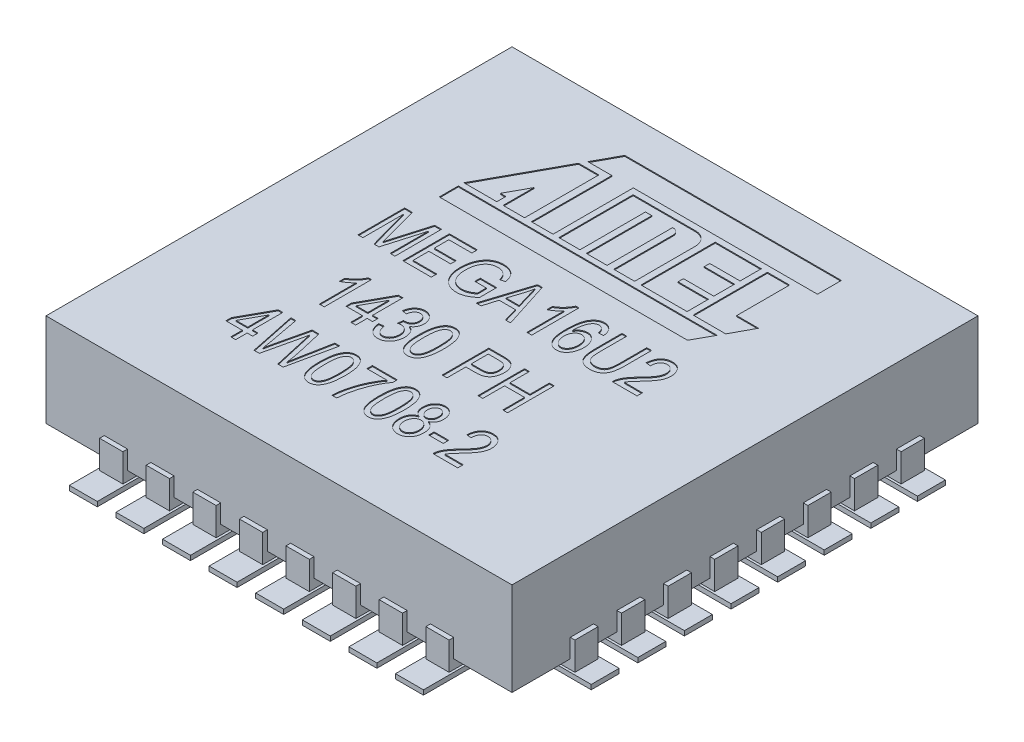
SolidWorks part; units mm, degrees
ref_plane "Plan de face" through (0, 0, 0) normal (0, 0, 1) x (1, 0, 0)
ref_plane "Plan de dessus" through (0, 0, 0) normal (0, 1, 0) x (1, 0, 0)
ref_plane "Plan de droite" through (0, 0, 0) normal (1, 0, 0) x (0, 0, -1)
sketch "Esquisse1" plane through (0, 0, 0) normal (0, 1, 0) x (1, 0, 0)
  line L1 (0, 0) -> (5, 0)
  line L2 (0, 0) -> (0, 5)
  line L3 (0, 5) -> (5, 5)
  line L4 (5, 0) -> (5, 5)
  dimension "D1" = 5
  dimension "D2" = 5
extrude "Boss.-Extru.1" add sketch "Esquisse1" along normal blind 1
sketch "Esquisse2" plane through (0, 0, 0) normal (0, -1, 0) x (1, 0, 0)
  line L0 (0, 0) -> (5, 0) construction
  line L1 (0.625, 0.05) -> (0.875, 0.05)
  line L2 (0.625, 0.05) -> (0.625, -0.2)
  line L3 (1.125, 0.05) -> (1.375, 0.05)
  line L4 (0.875, 0.05) -> (0.875, -0.2)
  line L5 (1.125, 0.05) -> (1.125, -0.2)
  line L6 (1.375, 0.05) -> (1.375, -0.2)
  line L7 (1.625, 0.05) -> (1.875, 0.05)
  line L8 (1.625, 0.05) -> (1.625, -0.2)
  line L9 (1.875, 0.05) -> (1.875, -0.2)
  line L10 (2.125, 0.05) -> (2.375, 0.05)
  line L11 (2.125, 0.05) -> (2.125, -0.2)
  line L12 (2.375, 0.05) -> (2.375, -0.2)
  line L13 (2.625, 0.05) -> (2.875, 0.05)
  line L14 (2.625, 0.05) -> (2.625, -0.2)
  line L15 (2.875, 0.05) -> (2.875, -0.2)
  line L16 (3.125, 0.05) -> (3.375, 0.05)
  line L17 (3.125, 0.05) -> (3.125, -0.2)
  line L18 (3.375, 0.05) -> (3.375, -0.2)
  line L19 (3.625, 0.05) -> (3.875, 0.05)
  line L20 (3.625, 0.05) -> (3.625, -0.2)
  line L21 (3.875, 0.05) -> (3.875, -0.2)
  line L22 (4.125, 0.05) -> (4.375, 0.05)
  line L23 (4.125, 0.05) -> (4.125, -0.2)
  line L24 (4.375, 0.05) -> (4.375, -0.2)
  line L25 (0.625, 0.05) -> (0, 0) construction
  line L26 (4.375, 0.05) -> (5, 0) construction
  line L27 (-0.05, -1.125) -> (-0.05, -1.375)
  line L28 (0.2, -0.625) -> (-0.05, -0.625)
  line L29 (-0.05, -0.625) -> (-0.05, -0.875)
  line L30 (-0.05, -0.875) -> (0.2, -0.875)
  line L31 (0, -5) -> (0, 0) construction
  line L32 (0.2, -1.125) -> (-0.05, -1.125)
  line L33 (-0.05, -1.375) -> (0.2, -1.375)
  line L34 (-0.05, -1.625) -> (-0.05, -1.875)
  line L35 (0.2, -1.625) -> (-0.05, -1.625)
  line L36 (-0.05, -1.875) -> (0.2, -1.875)
  line L37 (-0.05, -2.125) -> (-0.05, -2.375)
  line L38 (0.2, -2.125) -> (-0.05, -2.125)
  line L39 (-0.05, -2.375) -> (0.2, -2.375)
  line L40 (-0.05, -2.625) -> (-0.05, -2.875)
  line L41 (0.2, -2.625) -> (-0.05, -2.625)
  line L42 (-0.05, -2.875) -> (0.2, -2.875)
  line L43 (-0.05, -3.125) -> (-0.05, -3.375)
  line L44 (0.2, -3.125) -> (-0.05, -3.125)
  line L45 (-0.05, -3.375) -> (0.2, -3.375)
  line L46 (-0.05, -3.625) -> (-0.05, -3.875)
  line L47 (0.2, -3.625) -> (-0.05, -3.625)
  line L48 (-0.05, -3.875) -> (0.2, -3.875)
  line L49 (-0.05, -4.125) -> (-0.05, -4.375)
  line L50 (0.2, -4.125) -> (-0.05, -4.125)
  line L51 (-0.05, -4.375) -> (0.2, -4.375)
  line L52 (-0.05, -0.625) -> (0, 0) construction
  line L53 (-0.05, -4.375) -> (0, -5) construction
  line L54 (0.625, -5.05) -> (0.625, -4.8)
  line L55 (0.625, -5.05) -> (0.875, -5.05)
  line L56 (0.875, -5.05) -> (0.875, -4.8)
  line L57 (5, -5) -> (0, -5) construction
  line L58 (1.125, -5.05) -> (1.375, -5.05)
  line L59 (1.125, -5.05) -> (1.125, -4.8)
  line L60 (1.375, -5.05) -> (1.375, -4.8)
  line L61 (1.625, -5.05) -> (1.875, -5.05)
  line L62 (1.625, -5.05) -> (1.625, -4.8)
  line L63 (1.875, -5.05) -> (1.875, -4.8)
  line L64 (2.125, -5.05) -> (2.375, -5.05)
  line L65 (2.125, -5.05) -> (2.125, -4.8)
  line L66 (2.375, -5.05) -> (2.375, -4.8)
  line L67 (2.625, -5.05) -> (2.875, -5.05)
  line L68 (2.625, -5.05) -> (2.625, -4.8)
  line L69 (2.875, -5.05) -> (2.875, -4.8)
  line L70 (3.125, -5.05) -> (3.375, -5.05)
  line L71 (3.125, -5.05) -> (3.125, -4.8)
  line L72 (3.375, -5.05) -> (3.375, -4.8)
  line L73 (3.625, -5.05) -> (3.875, -5.05)
  line L74 (3.625, -5.05) -> (3.625, -4.8)
  line L75 (3.875, -5.05) -> (3.875, -4.8)
  line L76 (4.125, -5.05) -> (4.375, -5.05)
  line L77 (4.125, -5.05) -> (4.125, -4.8)
  line L78 (4.375, -5.05) -> (4.375, -4.8)
  line L79 (0, -5) -> (0.625, -5.05) construction
  line L80 (4.375, -5.05) -> (5, -5) construction
  line L81 (4.8, -4.375) -> (5.05, -4.375)
  line L82 (5.05, -4.375) -> (5.05, -4.125)
  line L83 (5.05, -4.125) -> (4.8, -4.125)
  line L84 (5, 0) -> (5, -5) construction
  line L85 (4.8, -3.875) -> (5.05, -3.875)
  line L86 (5.05, -3.875) -> (5.05, -3.625)
  line L87 (5.05, -3.625) -> (4.8, -3.625)
  line L88 (4.8, -3.375) -> (5.05, -3.375)
  line L89 (5.05, -3.375) -> (5.05, -3.125)
  line L90 (5.05, -3.125) -> (4.8, -3.125)
  line L91 (4.8, -2.875) -> (5.05, -2.875)
  line L92 (5.05, -2.875) -> (5.05, -2.625)
  line L93 (5.05, -2.625) -> (4.8, -2.625)
  line L94 (4.8, -2.375) -> (5.05, -2.375)
  line L95 (5.05, -2.375) -> (5.05, -2.125)
  line L96 (5.05, -2.125) -> (4.8, -2.125)
  line L97 (4.8, -1.875) -> (5.05, -1.875)
  line L98 (5.05, -1.875) -> (5.05, -1.625)
  line L99 (5.05, -1.625) -> (4.8, -1.625)
  line L100 (4.8, -1.375) -> (5.05, -1.375)
  line L101 (5.05, -1.375) -> (5.05, -1.125)
  line L102 (5.05, -1.125) -> (4.8, -1.125)
  line L103 (4.8, -0.875) -> (5.05, -0.875)
  line L104 (5.05, -0.875) -> (5.05, -0.625)
  line L105 (5.05, -0.625) -> (4.8, -0.625)
  line L106 (5, -5) -> (5.05, -4.375) construction
  line L107 (5, 0) -> (5.05, -0.625) construction
  arc A0 (0.625, -0.2) -> (0.875, -0.2) centre (0.75, -0.2) ccw
  arc A1 (1.125, -0.2) -> (1.375, -0.2) centre (1.25, -0.2) ccw
  arc A2 (1.625, -0.2) -> (1.875, -0.2) centre (1.75, -0.2) ccw
  arc A3 (2.125, -0.2) -> (2.375, -0.2) centre (2.25, -0.2) ccw
  arc A4 (2.625, -0.2) -> (2.875, -0.2) centre (2.75, -0.2) ccw
  arc A5 (3.125, -0.2) -> (3.375, -0.2) centre (3.25, -0.2) ccw
  arc A6 (3.625, -0.2) -> (3.875, -0.2) centre (3.75, -0.2) ccw
  arc A7 (4.125, -0.2) -> (4.375, -0.2) centre (4.25, -0.2) ccw
  arc A8 (0.2, -0.875) -> (0.2, -0.625) centre (0.2, -0.75) ccw
  arc A9 (0.2, -1.375) -> (0.2, -1.125) centre (0.2, -1.25) ccw
  arc A10 (0.2, -1.875) -> (0.2, -1.625) centre (0.2, -1.75) ccw
  arc A11 (0.2, -2.375) -> (0.2, -2.125) centre (0.2, -2.25) ccw
  arc A12 (0.2, -2.875) -> (0.2, -2.625) centre (0.2, -2.75) ccw
  arc A13 (0.2, -3.375) -> (0.2, -3.125) centre (0.2, -3.25) ccw
  arc A14 (0.2, -3.875) -> (0.2, -3.625) centre (0.2, -3.75) ccw
  arc A15 (0.2, -4.375) -> (0.2, -4.125) centre (0.2, -4.25) ccw
  arc A16 (0.875, -4.8) -> (0.625, -4.8) centre (0.75, -4.8) ccw
  arc A17 (1.375, -4.8) -> (1.125, -4.8) centre (1.25, -4.8) ccw
  arc A18 (1.875, -4.8) -> (1.625, -4.8) centre (1.75, -4.8) ccw
  arc A19 (2.375, -4.8) -> (2.125, -4.8) centre (2.25, -4.8) ccw
  arc A20 (2.875, -4.8) -> (2.625, -4.8) centre (2.75, -4.8) ccw
  arc A21 (3.375, -4.8) -> (3.125, -4.8) centre (3.25, -4.8) ccw
  arc A22 (3.875, -4.8) -> (3.625, -4.8) centre (3.75, -4.8) ccw
  arc A23 (4.375, -4.8) -> (4.125, -4.8) centre (4.25, -4.8) ccw
  arc A24 (4.8, -4.375) -> (4.8, -4.125) centre (4.8, -4.25) cw
  arc A25 (4.8, -3.875) -> (4.8, -3.625) centre (4.8, -3.75) cw
  arc A26 (4.8, -3.375) -> (4.8, -3.125) centre (4.8, -3.25) cw
  arc A27 (4.8, -2.875) -> (4.8, -2.625) centre (4.8, -2.75) cw
  arc A28 (4.8, -2.375) -> (4.8, -2.125) centre (4.8, -2.25) cw
  arc A29 (4.8, -1.875) -> (4.8, -1.625) centre (4.8, -1.75) cw
  arc A30 (4.8, -1.375) -> (4.8, -1.125) centre (4.8, -1.25) cw
  arc A31 (4.8, -0.875) -> (4.8, -0.625) centre (4.8, -0.75) cw
  dimension "D1" = 0.25
  dimension "D2" = 0.05
  dimension "D3" = 0.25
  dimension "D5" = 0.25
  dimension "D6" = 0.05
  dimension "D7" = 0.25
  dimension "D9" = 0.25
  dimension "D10" = 0.05
  dimension "D11" = 0.25
  dimension "D13" = 0.25
  dimension "D14" = 0.05
  dimension "D15" = 0.25
  dimension "D4" = 8
  dimension "D8" = 8
  dimension "D12" = 8
  dimension "D16" = 8
extrude "Boss.-Extru.2" add sketch "Esquisse2" along normal blind 0.1 separate body
sketch "Esquisse3" plane through (0, 0, 0) normal (0, 1, 0) x (1, 0, 0)
  line L0 (0.875, 5.05) -> (0.875, 4.8) construction
  line L1 (0.625, 5.05) -> (0.875, 5.05)
  line L2 (0.625, 5.05) -> (0.625, 5)
  line L3 (0.625, 5) -> (0.875, 5)
  line L4 (0.875, 5.05) -> (0.875, 5)
  line L5 (5, 5) -> (0, 5) construction
  line L6 (1.125, 5.05) -> (1.125, 5)
  line L7 (1.125, 5.05) -> (1.375, 5.05)
  line L8 (1.375, 5.05) -> (1.375, 5)
  line L9 (1.125, 5) -> (1.375, 5)
  line L10 (1.625, 5.05) -> (1.625, 5)
  line L11 (1.625, 5.05) -> (1.875, 5.05)
  line L12 (1.875, 5.05) -> (1.875, 5)
  line L13 (1.625, 5) -> (1.875, 5)
  line L14 (2.125, 5.05) -> (2.125, 5)
  line L15 (2.125, 5.05) -> (2.375, 5.05)
  line L16 (2.375, 5.05) -> (2.375, 5)
  line L17 (2.125, 5) -> (2.375, 5)
  line L18 (2.625, 5.05) -> (2.625, 5)
  line L19 (2.625, 5.05) -> (2.875, 5.05)
  line L20 (2.875, 5.05) -> (2.875, 5)
  line L21 (2.625, 5) -> (2.875, 5)
  line L22 (3.125, 5.05) -> (3.125, 5)
  line L23 (3.125, 5.05) -> (3.375, 5.05)
  line L24 (3.375, 5.05) -> (3.375, 5)
  line L25 (3.125, 5) -> (3.375, 5)
  line L26 (3.625, 5.05) -> (3.625, 5)
  line L27 (3.625, 5.05) -> (3.875, 5.05)
  line L28 (3.875, 5.05) -> (3.875, 5)
  line L29 (3.625, 5) -> (3.875, 5)
  line L30 (4.125, 5.05) -> (4.125, 5)
  line L31 (4.125, 5.05) -> (4.375, 5.05)
  line L32 (4.375, 5.05) -> (4.375, 5)
  line L33 (4.125, 5) -> (4.375, 5)
  line L34 (5, 0) -> (5, 5) construction
  line L35 (5.05, 4.375) -> (5, 4.375)
  line L36 (5.05, 4.375) -> (5.05, 4.125)
  line L37 (5.05, 4.125) -> (5, 4.125)
  line L38 (5, 4.375) -> (5, 4.125)
  line L39 (5.05, 4.125) -> (4.8, 4.125) construction
  line L40 (5.05, 3.875) -> (5, 3.875)
  line L41 (5.05, 3.875) -> (5.05, 3.625)
  line L42 (5.05, 3.625) -> (5, 3.625)
  line L43 (5, 3.875) -> (5, 3.625)
  line L44 (5.05, 3.375) -> (5, 3.375)
  line L45 (5.05, 3.375) -> (5.05, 3.125)
  line L46 (5.05, 3.125) -> (5, 3.125)
  line L47 (5, 3.375) -> (5, 3.125)
  line L48 (5.05, 2.875) -> (5, 2.875)
  line L49 (5.05, 2.875) -> (5.05, 2.625)
  line L50 (5.05, 2.625) -> (5, 2.625)
  line L51 (5, 2.875) -> (5, 2.625)
  line L52 (5.05, 2.375) -> (5, 2.375)
  line L53 (5.05, 2.375) -> (5.05, 2.125)
  line L54 (5.05, 2.125) -> (5, 2.125)
  line L55 (5, 2.375) -> (5, 2.125)
  line L56 (5.05, 1.875) -> (5, 1.875)
  line L57 (5.05, 1.875) -> (5.05, 1.625)
  line L58 (5.05, 1.625) -> (5, 1.625)
  line L59 (5, 1.875) -> (5, 1.625)
  line L60 (5.05, 1.375) -> (5, 1.375)
  line L61 (5.05, 1.375) -> (5.05, 1.125)
  line L62 (5.05, 1.125) -> (5, 1.125)
  line L63 (5, 1.375) -> (5, 1.125)
  line L64 (5.05, 0.875) -> (5, 0.875)
  line L65 (5.05, 0.875) -> (5.05, 0.625)
  line L66 (5.05, 0.625) -> (5, 0.625)
  line L67 (5, 0.875) -> (5, 0.625)
  line L68 (0, 0) -> (5, 0) construction
  line L69 (4.375, -0.05) -> (4.125, -0.05)
  line L70 (4.375, -0.05) -> (4.375, 0)
  line L71 (4.375, 0) -> (4.125, 0)
  line L72 (4.125, -0.05) -> (4.125, 0)
  line L73 (3.875, 0) -> (3.625, 0)
  line L74 (3.625, -0.05) -> (3.625, 0)
  line L75 (3.875, -0.05) -> (3.625, -0.05)
  line L76 (3.875, -0.05) -> (3.875, 0)
  line L77 (3.375, 0) -> (3.125, 0)
  line L78 (3.125, -0.05) -> (3.125, 0)
  line L79 (3.375, -0.05) -> (3.125, -0.05)
  line L80 (3.375, -0.05) -> (3.375, 0)
  line L81 (2.875, 0) -> (2.625, 0)
  line L82 (2.625, -0.05) -> (2.625, 0)
  line L83 (2.875, -0.05) -> (2.625, -0.05)
  line L84 (2.875, -0.05) -> (2.875, 0)
  line L85 (2.375, 0) -> (2.125, 0)
  line L86 (2.125, -0.05) -> (2.125, 0)
  line L87 (2.375, -0.05) -> (2.125, -0.05)
  line L88 (2.375, -0.05) -> (2.375, 0)
  line L89 (1.875, 0) -> (1.625, 0)
  line L90 (1.625, -0.05) -> (1.625, 0)
  line L91 (1.875, -0.05) -> (1.625, -0.05)
  line L92 (1.875, -0.05) -> (1.875, 0)
  line L93 (1.375, 0) -> (1.125, 0)
  line L94 (1.125, -0.05) -> (1.125, 0)
  line L95 (1.375, -0.05) -> (1.125, -0.05)
  line L96 (1.375, -0.05) -> (1.375, 0)
  line L97 (0.875, 0) -> (0.625, 0)
  line L98 (0.625, -0.05) -> (0.625, 0)
  line L99 (0.875, -0.05) -> (0.625, -0.05)
  line L100 (0.875, -0.05) -> (0.875, 0)
  line L101 (0.2, 0.625) -> (-0.05, 0.625) construction
  line L102 (-0.05, 0.875) -> (0, 0.875)
  line L103 (-0.05, 0.875) -> (-0.05, 0.625)
  line L104 (-0.05, 0.625) -> (0, 0.625)
  line L105 (0, 0.875) -> (0, 0.625)
  line L106 (0, 5) -> (0, 0) construction
  line L107 (-0.05, 1.375) -> (0, 1.375)
  line L108 (-0.05, 1.375) -> (-0.05, 1.125)
  line L109 (-0.05, 1.125) -> (0, 1.125)
  line L110 (0, 1.375) -> (0, 1.125)
  line L111 (-0.05, 1.875) -> (0, 1.875)
  line L112 (-0.05, 1.875) -> (-0.05, 1.625)
  line L113 (-0.05, 1.625) -> (0, 1.625)
  line L114 (0, 1.875) -> (0, 1.625)
  line L115 (-0.05, 2.375) -> (0, 2.375)
  line L116 (-0.05, 2.375) -> (-0.05, 2.125)
  line L117 (-0.05, 2.125) -> (0, 2.125)
  line L118 (0, 2.375) -> (0, 2.125)
  line L119 (-0.05, 2.875) -> (0, 2.875)
  line L120 (-0.05, 2.875) -> (-0.05, 2.625)
  line L121 (-0.05, 2.625) -> (0, 2.625)
  line L122 (0, 2.875) -> (0, 2.625)
  line L123 (-0.05, 3.375) -> (0, 3.375)
  line L124 (-0.05, 3.375) -> (-0.05, 3.125)
  line L125 (-0.05, 3.125) -> (0, 3.125)
  line L126 (0, 3.375) -> (0, 3.125)
  line L127 (-0.05, 3.875) -> (0, 3.875)
  line L128 (-0.05, 3.875) -> (-0.05, 3.625)
  line L129 (-0.05, 3.625) -> (0, 3.625)
  line L130 (0, 3.875) -> (0, 3.625)
  line L131 (-0.05, 4.375) -> (0, 4.375)
  line L132 (-0.05, 4.375) -> (-0.05, 4.125)
  line L133 (-0.05, 4.125) -> (0, 4.125)
  line L134 (0, 4.375) -> (0, 4.125)
  dimension "D1" = 8
  dimension "D2" = 8
  dimension "D3" = 8
  dimension "D4" = 8
extrude "Boss.-Extru.3" add sketch "Esquisse3" along normal blind 0.2
sketch "Esquisse4" plane through (0, -0.1, 0) normal (0, -1, 0) x (1, 0, 0)
  line L0 (0.875, 0.05) -> (0.625, 0.05) construction
  line L1 (0.6, 0.35) -> (0.9, 0.35)
  line L2 (0.6, 0.35) -> (0.6, -0.35)
  line L3 (0.6, -0.35) -> (0.9, -0.35)
  line L4 (0.9, 0.35) -> (0.9, -0.35)
  line L5 (0.625, 0.05) -> (0.6, 0.35) construction
  line L6 (0.875, 0.05) -> (0.9, 0.35) construction
  line L7 (1.1, 0.35) -> (1.4, 0.35)
  line L8 (1.1, 0.35) -> (1.1, -0.35)
  line L9 (1.1, -0.35) -> (1.4, -0.35)
  line L10 (1.4, 0.35) -> (1.4, -0.35)
  line L11 (1.6, 0.35) -> (1.9, 0.35)
  line L12 (1.6, 0.35) -> (1.6, -0.35)
  line L13 (1.6, -0.35) -> (1.9, -0.35)
  line L14 (1.9, 0.35) -> (1.9, -0.35)
  line L15 (2.1, 0.35) -> (2.4, 0.35)
  line L16 (2.1, 0.35) -> (2.1, -0.35)
  line L17 (2.1, -0.35) -> (2.4, -0.35)
  line L18 (2.4, 0.35) -> (2.4, -0.35)
  line L19 (2.6, 0.35) -> (2.9, 0.35)
  line L20 (2.6, 0.35) -> (2.6, -0.35)
  line L21 (2.6, -0.35) -> (2.9, -0.35)
  line L22 (2.9, 0.35) -> (2.9, -0.35)
  line L23 (3.1, 0.35) -> (3.4, 0.35)
  line L24 (3.1, 0.35) -> (3.1, -0.35)
  line L25 (3.1, -0.35) -> (3.4, -0.35)
  line L26 (3.4, 0.35) -> (3.4, -0.35)
  line L27 (3.6, 0.35) -> (3.9, 0.35)
  line L28 (3.6, 0.35) -> (3.6, -0.35)
  line L29 (3.6, -0.35) -> (3.9, -0.35)
  line L30 (3.9, 0.35) -> (3.9, -0.35)
  line L31 (4.1, 0.35) -> (4.4, 0.35)
  line L32 (4.1, 0.35) -> (4.1, -0.35)
  line L33 (4.1, -0.35) -> (4.4, -0.35)
  line L34 (4.4, 0.35) -> (4.4, -0.35)
  line L36 (5.05, -0.875) -> (5.05, -0.625) construction
  line L37 (4.55, -0.6) -> (5.25, -0.6)
  line L38 (4.55, -0.6) -> (4.55, -0.9)
  line L39 (4.55, -0.9) -> (5.25, -0.9)
  line L40 (5.25, -0.6) -> (5.25, -0.9)
  line L41 (5.05, -0.625) -> (5.25, -0.6) construction
  line L42 (5.05, -0.875) -> (5.25, -0.9) construction
  line L43 (4.55, -1.1) -> (5.25, -1.1)
  line L44 (4.55, -1.1) -> (4.55, -1.4)
  line L45 (4.55, -1.4) -> (5.25, -1.4)
  line L46 (5.25, -1.1) -> (5.25, -1.4)
  line L47 (4.55, -1.6) -> (5.25, -1.6)
  line L48 (4.55, -1.6) -> (4.55, -1.9)
  line L49 (4.55, -1.9) -> (5.25, -1.9)
  line L50 (5.25, -1.6) -> (5.25, -1.9)
  line L51 (4.55, -2.1) -> (5.25, -2.1)
  line L52 (4.55, -2.1) -> (4.55, -2.4)
  line L53 (4.55, -2.4) -> (5.25, -2.4)
  line L54 (5.25, -2.1) -> (5.25, -2.4)
  line L55 (4.55, -2.6) -> (5.25, -2.6)
  line L56 (4.55, -2.6) -> (4.55, -2.9)
  line L57 (4.55, -2.9) -> (5.25, -2.9)
  line L58 (5.25, -2.6) -> (5.25, -2.9)
  line L59 (4.55, -3.1) -> (5.25, -3.1)
  line L60 (4.55, -3.1) -> (4.55, -3.4)
  line L61 (4.55, -3.4) -> (5.25, -3.4)
  line L62 (5.25, -3.1) -> (5.25, -3.4)
  line L63 (4.55, -3.6) -> (5.25, -3.6)
  line L64 (4.55, -3.6) -> (4.55, -3.9)
  line L65 (4.55, -3.9) -> (5.25, -3.9)
  line L66 (5.25, -3.6) -> (5.25, -3.9)
  line L67 (4.55, -4.1) -> (5.25, -4.1)
  line L68 (4.55, -4.1) -> (4.55, -4.4)
  line L69 (4.55, -4.4) -> (5.25, -4.4)
  line L70 (5.25, -4.1) -> (5.25, -4.4)
  line L72 (4.125, -5.05) -> (4.375, -5.05) construction
  line L73 (4.1, -5.25) -> (4.4, -5.25)
  line L74 (4.1, -5.25) -> (4.1, -4.55)
  line L75 (4.1, -4.55) -> (4.4, -4.55)
  line L76 (4.4, -5.25) -> (4.4, -4.55)
  line L77 (4.1, -5.25) -> (4.125, -5.05) construction
  line L78 (4.375, -5.05) -> (4.4, -5.25) construction
  line L79 (3.9, -5.25) -> (3.9, -4.55)
  line L80 (3.6, -5.25) -> (3.9, -5.25)
  line L81 (3.6, -5.25) -> (3.6, -4.55)
  line L82 (3.6, -4.55) -> (3.9, -4.55)
  line L83 (3.4, -5.25) -> (3.4, -4.55)
  line L84 (3.1, -5.25) -> (3.4, -5.25)
  line L85 (3.1, -5.25) -> (3.1, -4.55)
  line L86 (3.1, -4.55) -> (3.4, -4.55)
  line L87 (2.9, -5.25) -> (2.9, -4.55)
  line L88 (2.6, -5.25) -> (2.9, -5.25)
  line L89 (2.6, -5.25) -> (2.6, -4.55)
  line L90 (2.6, -4.55) -> (2.9, -4.55)
  line L91 (2.4, -5.25) -> (2.4, -4.55)
  line L92 (2.1, -5.25) -> (2.4, -5.25)
  line L93 (2.1, -5.25) -> (2.1, -4.55)
  line L94 (2.1, -4.55) -> (2.4, -4.55)
  line L95 (1.9, -5.25) -> (1.9, -4.55)
  line L96 (1.6, -5.25) -> (1.9, -5.25)
  line L97 (1.6, -5.25) -> (1.6, -4.55)
  line L98 (1.6, -4.55) -> (1.9, -4.55)
  line L99 (1.4, -5.25) -> (1.4, -4.55)
  line L100 (1.1, -5.25) -> (1.4, -5.25)
  line L101 (1.1, -5.25) -> (1.1, -4.55)
  line L102 (1.1, -4.55) -> (1.4, -4.55)
  line L103 (0.9, -5.25) -> (0.9, -4.55)
  line L104 (0.6, -5.25) -> (0.9, -5.25)
  line L105 (0.6, -5.25) -> (0.6, -4.55)
  line L106 (0.6, -4.55) -> (0.9, -4.55)
  line L108 (-0.05, -4.125) -> (-0.05, -4.375) construction
  line L109 (-0.25, -4.1) -> (0.45, -4.1)
  line L110 (-0.25, -4.1) -> (-0.25, -4.4)
  line L111 (-0.25, -4.4) -> (0.45, -4.4)
  line L112 (0.45, -4.1) -> (0.45, -4.4)
  line L113 (-0.05, -4.125) -> (-0.25, -4.1) construction
  line L114 (-0.05, -4.375) -> (-0.25, -4.4) construction
  line L115 (-0.25, -3.6) -> (-0.25, -3.9)
  line L116 (-0.25, -3.6) -> (0.45, -3.6)
  line L117 (0.45, -3.6) -> (0.45, -3.9)
  line L118 (-0.25, -3.9) -> (0.45, -3.9)
  line L119 (-0.25, -3.1) -> (-0.25, -3.4)
  line L120 (-0.25, -3.1) -> (0.45, -3.1)
  line L121 (0.45, -3.1) -> (0.45, -3.4)
  line L122 (-0.25, -3.4) -> (0.45, -3.4)
  line L123 (-0.25, -2.6) -> (-0.25, -2.9)
  line L124 (-0.25, -2.6) -> (0.45, -2.6)
  line L125 (0.45, -2.6) -> (0.45, -2.9)
  line L126 (-0.25, -2.9) -> (0.45, -2.9)
  line L127 (-0.25, -2.1) -> (-0.25, -2.4)
  line L128 (-0.25, -2.1) -> (0.45, -2.1)
  line L129 (0.45, -2.1) -> (0.45, -2.4)
  line L130 (-0.25, -2.4) -> (0.45, -2.4)
  line L131 (-0.25, -1.6) -> (-0.25, -1.9)
  line L132 (-0.25, -1.6) -> (0.45, -1.6)
  line L133 (0.45, -1.6) -> (0.45, -1.9)
  line L134 (-0.25, -1.9) -> (0.45, -1.9)
  line L135 (-0.25, -1.1) -> (-0.25, -1.4)
  line L136 (-0.25, -1.1) -> (0.45, -1.1)
  line L137 (0.45, -1.1) -> (0.45, -1.4)
  line L138 (-0.25, -1.4) -> (0.45, -1.4)
  line L139 (-0.25, -0.6) -> (-0.25, -0.9)
  line L140 (-0.25, -0.6) -> (0.45, -0.6)
  line L141 (0.45, -0.6) -> (0.45, -0.9)
  line L142 (-0.25, -0.9) -> (0.45, -0.9)
  dimension "D1" = 0.3
  dimension "D2" = 0.7
  dimension "D3" = 0.3
  dimension "D5" = 0.3
  dimension "D6" = 0.7
  dimension "D7" = 0.2
  dimension "D9" = 0.3
  dimension "D10" = 0.7
  dimension "D11" = 0.2
  dimension "D13" = 0.3
  dimension "D14" = 0.7
  dimension "D15" = 0.2
  dimension "D4" = 8
  dimension "D8" = 8
  dimension "D12" = 8
  dimension "D16" = 8
extrude "Boss.-Extru.4" add sketch "Esquisse4" along normal blind 0.05 separate body
sketch "Esquisse5" plane through (0, 0, 0) normal (0, -1, 0) x (1, 0, 0)
  line L0 (0.7, -0.7) -> (0, 0) construction
  line L1 (0.9, -0.7) -> (4.1, -0.7)
  line L2 (0.7, -0.9) -> (0.7, -4.1)
  line L3 (0.9, -4.3) -> (4.1, -4.3)
  line L4 (4.3, -0.9) -> (4.3, -4.1)
  line L5 (4.3, -0.7) -> (5, 0) construction
  line L6 (4.3, -4.3) -> (5, -5) construction
  arc A0 (4.1, -0.7) -> (4.3, -0.9) centre (4.1, -0.9) cw
  arc A1 (4.3, -4.1) -> (4.1, -4.3) centre (4.1, -4.1) cw
  arc A2 (0.9, -4.3) -> (0.7, -4.1) centre (0.9, -4.1) cw
  arc A3 (0.7, -0.9) -> (0.9, -0.7) centre (0.9, -0.9) cw
  point P18 (0.7, -4.3)
  dimension "D3" = 0.2
  dimension "D1" = 3.6
  dimension "D2" = 3.6
extrude "Boss.-Extru.5" add sketch "Esquisse5" along normal blind 0.125
sketch "Esquisse6" plane through (0, 1, 0) normal (0, 1, 0) x (1, 0, 0)
  line L0 (343.1404, 485.7777) -> (1711.1404, 485.7777) construction
  line L1 (1.0048, 3.2148) -> (1.0048, 3.4194)
  line L2 (1.0048, 3.4194) -> (3.7813, 3.4194)
  line L3 (3.7813, 3.4194) -> (3.6682, 3.2148)
  line L4 (3.6682, 3.2148) -> (1.0048, 3.2148)
  line L5 (1.0048, 3.4789) -> (1.4389, 4.2753)
  line L6 (1.4389, 4.2753) -> (1.6563, 4.2753)
  line L7 (1.6563, 4.2753) -> (1.6563, 3.4789)
  line L8 (1.6563, 3.4789) -> (1.426, 3.4789)
  line L9 (1.426, 3.4789) -> (1.426, 3.8091)
  line L10 (1.426, 3.8091) -> (1.2991, 3.5762)
  line L11 (1.2991, 3.5762) -> (1.358, 3.5762)
  line L12 (1.358, 3.5762) -> (1.358, 3.4789)
  line L13 (1.358, 3.4789) -> (1.0048, 3.4789)
  line L14 (1.4741, 4.3397) -> (1.6139, 4.5962)
  line L15 (1.6139, 4.5962) -> (3.938, 4.5962)
  line L16 (3.938, 4.5962) -> (3.938, 4.3397)
  line L17 (3.938, 4.3397) -> (1.9615, 4.3397)
  line L18 (1.9615, 4.3397) -> (1.9615, 3.4789)
  line L19 (1.9615, 3.4789) -> (1.7293, 3.4789)
  line L20 (1.7319, 4.3397) -> (1.4741, 4.3397)
  line L21 (2.0243, 3.4789) -> (2.0243, 4.2753)
  line L22 (2.0243, 4.2753) -> (2.6955, 4.2753)
  line L23 (2.8369, 4.1338) -> (2.8369, 3.4789)
  line L24 (2.8369, 3.4789) -> (2.6135, 3.4789)
  line L25 (2.6135, 3.4789) -> (2.6135, 4.1228)
  line L26 (2.9052, 3.4789) -> (3.3996, 3.4789)
  line L27 (2.5416, 4.1811) -> (2.5416, 3.4789)
  line L28 (2.5416, 3.4789) -> (2.3188, 3.4789)
  line L29 (2.3188, 3.4789) -> (2.3188, 4.1811)
  line L30 (2.3188, 4.1811) -> (2.2507, 4.1811)
  line L31 (2.2507, 4.1811) -> (2.2507, 3.4789)
  line L32 (2.2507, 3.4789) -> (2.0243, 3.4789)
  line L33 (3.3996, 3.4789) -> (3.3996, 3.7076)
  line L34 (3.3996, 3.7076) -> (3.0744, 3.7076)
  line L35 (3.0744, 3.7076) -> (3.0744, 3.7653)
  line L36 (3.0744, 3.7653) -> (3.3996, 3.7653)
  line L37 (3.3996, 3.7653) -> (3.3996, 3.9883)
  line L38 (3.3996, 3.9883) -> (3.0744, 3.9883)
  line L39 (3.0744, 3.9883) -> (3.0744, 4.0476)
  line L40 (3.0744, 4.0476) -> (3.3996, 4.0476)
  line L41 (3.3996, 4.0476) -> (3.3996, 4.2753)
  line L42 (3.3996, 4.2753) -> (2.9052, 4.2753)
  line L43 (2.9052, 4.2753) -> (2.9052, 3.4789)
  line L44 (3.4649, 3.4789) -> (3.8142, 3.4789)
  line L45 (3.8142, 3.4789) -> (3.938, 3.7076)
  line L46 (3.938, 3.7076) -> (3.703, 3.7076)
  line L47 (3.703, 3.7076) -> (3.703, 4.2753)
  line L48 (3.703, 4.2753) -> (3.4649, 4.2753)
  line L49 (3.4649, 4.2753) -> (3.4649, 3.4789)
  line L50 (1.7319, 4.3397) -> (1.7293, 3.4789)
  line L51 (0.876, 2.4267) -> (3.6682, 2.4267) construction
  line L52 (1.195, 1.5759) -> (3.3218, 1.5759) construction
  line L53 (1.0048, 0.7961) -> (4.0574, 0.7961) construction
  arc A0 (2.6955, 4.2753) -> (2.8369, 4.1338) centre (2.6955, 4.1338) cw
  arc A1 (2.5416, 4.1811) -> (2.6135, 4.1228) centre (2.5484, 4.116) cw
  text T0 "MEGA16U2" font "Arial Narrow" height 0.5
  text T1 "1430 PH" font "Arial Narrow" height 0.5
  text T2 "4W0708-2" font "Arial Narrow" height 0.5
extrude "Enlèv. mat.-Extru.1" cut sketch "Esquisse6" against normal blind 0.01
